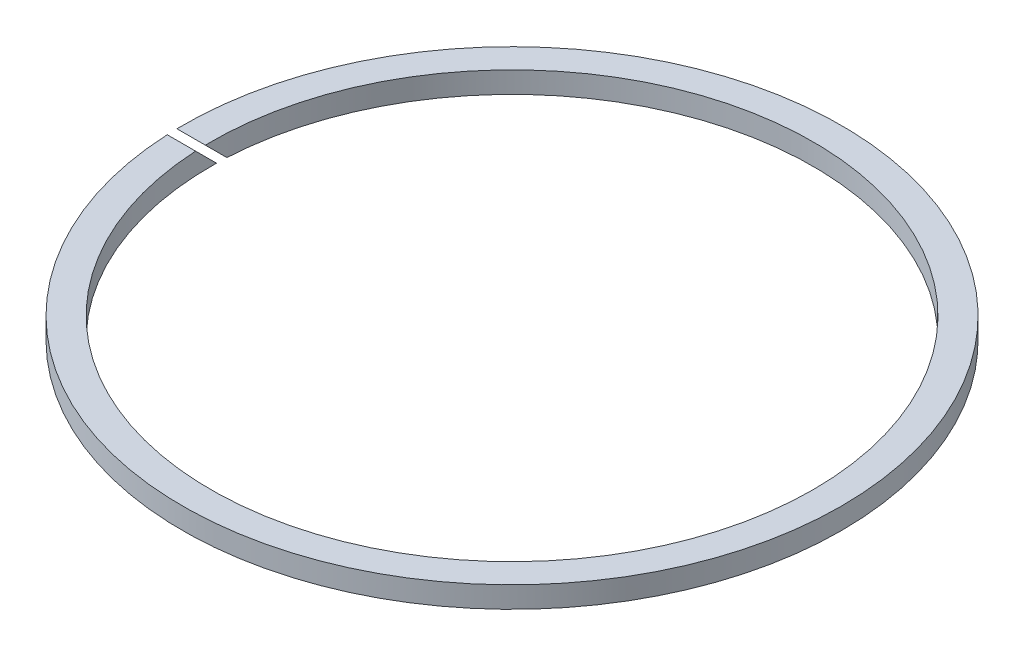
SolidWorks part; units mm, degrees
ref_plane "Front Plane" through (0, 0, 0) normal (0, 0, 1) x (1, 0, 0)
ref_plane "Top Plane" through (0, 0, 0) normal (0, 1, 0) x (1, 0, 0)
ref_plane "Right Plane" through (0, 0, 0) normal (1, 0, 0) x (0, 0, -1)
sketch "Sketch1" plane through (0, 0, 0) normal (0, 1, 0) x (1, 0, 0)
  circle A0 centre (0, 0) radius 42.5
  circle A1 centre (0, 0) radius 46.5
  dimension "D1" = 42.5
  dimension "D2" = 46.5
extrude "Boss-Extrude1" add sketch "Sketch1" along normal mid plane 3
sketch "Sketch2" plane through (0, 0, 0) normal (1, 0, 0) x (0, 0, -1)
  line L0 (-3.6729, 4.38) -> (4.38, -3.6729)
  line L1 (-3.6729, 4.38) -> (-4.38, 3.6729)
  line L2 (4.38, -3.6729) -> (3.6729, -4.38)
  line L3 (-4.38, 3.6729) -> (3.6729, -4.38)
  line L4 (-3.6729, 4.38) -> (3.6729, -4.38) construction
  line L5 (4.38, -3.6729) -> (-4.38, 3.6729) construction
  line L6 (0, 0) -> (9.7958, 0) construction
  point P1 (0, 0)
  dimension "D1" = 45
  dimension "D2" = 1
extrude "Cut-Extrude1" cut sketch "Sketch2" against normal up to next
